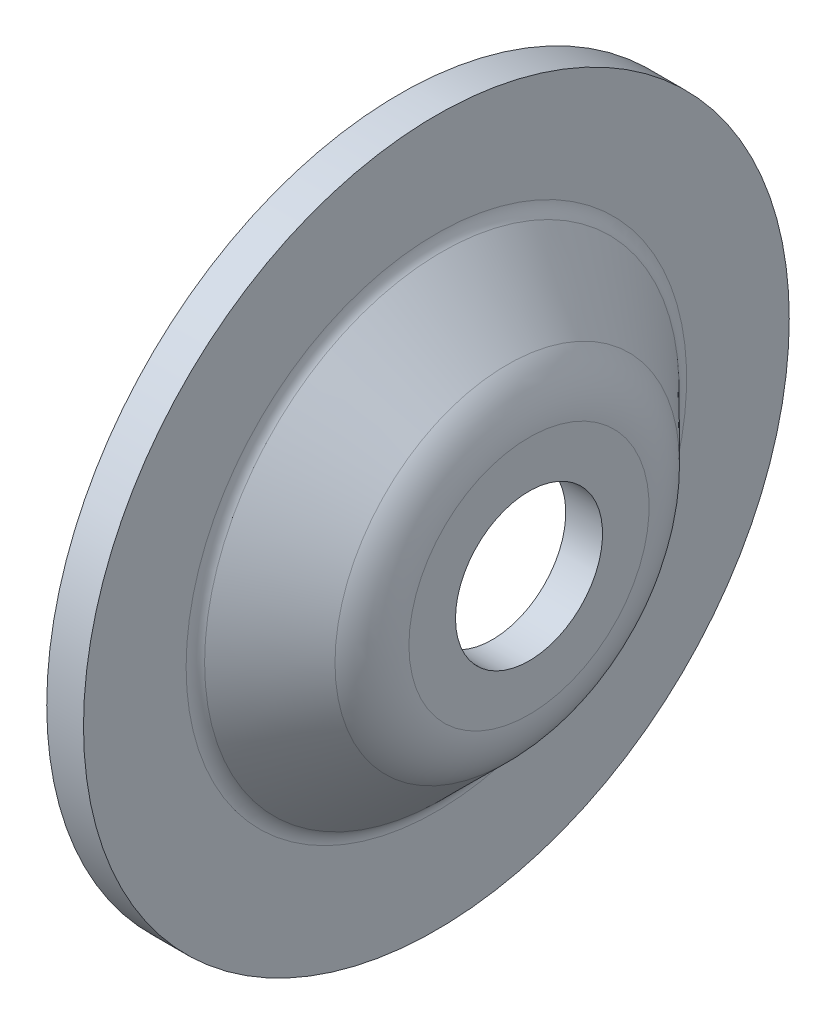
SolidWorks part; units mm, degrees
ref_plane "Plan1" through (0, 0, 0) normal (0, 0, 1) x (1, 0, 0)
ref_plane "Plan2" through (0, 0, 0) normal (0, 1, 0) x (1, 0, 0)
ref_plane "Plan3" through (0, 0, 0) normal (1, 0, 0) x (0, 0, -1)
sketch "Esquisse1" plane through (0, 0, 0) normal (0, 0, 1) x (1, 0, 0)
  line L0 (-28, 0) -> (39, 0) construction
  line L1 (12.04, 4) -> (12.04, 8.2)
  line L2 (12.04, 8.2) -> (7, 13.2)
  line L3 (7, 13.2) -> (7, 19.2)
  line L4 (7, 19.2) -> (5, 19.2)
  line L5 (5, 19.2) -> (5, 12.3669)
  line L6 (5, 12.3669) -> (10.04, 7.3669)
  line L7 (10.04, 7.3669) -> (10.04, 4)
  line L8 (10.04, 4) -> (12.04, 4)
  dimension "D1" = 4
  dimension "D2" = 2
  dimension "D3" = 5
  dimension "D4" = 19.2
  dimension "D5" = 7.04
  dimension "D6" = 6
  dimension "D7" = 2
revolve "Base-Révolution" add sketch "Esquisse1" angle 360 about L0
fillet "Congé1" radius 1
fillet "Congé2" radius 4
fillet "Congé4" radius 4
fillet "Congé5" radius 1
